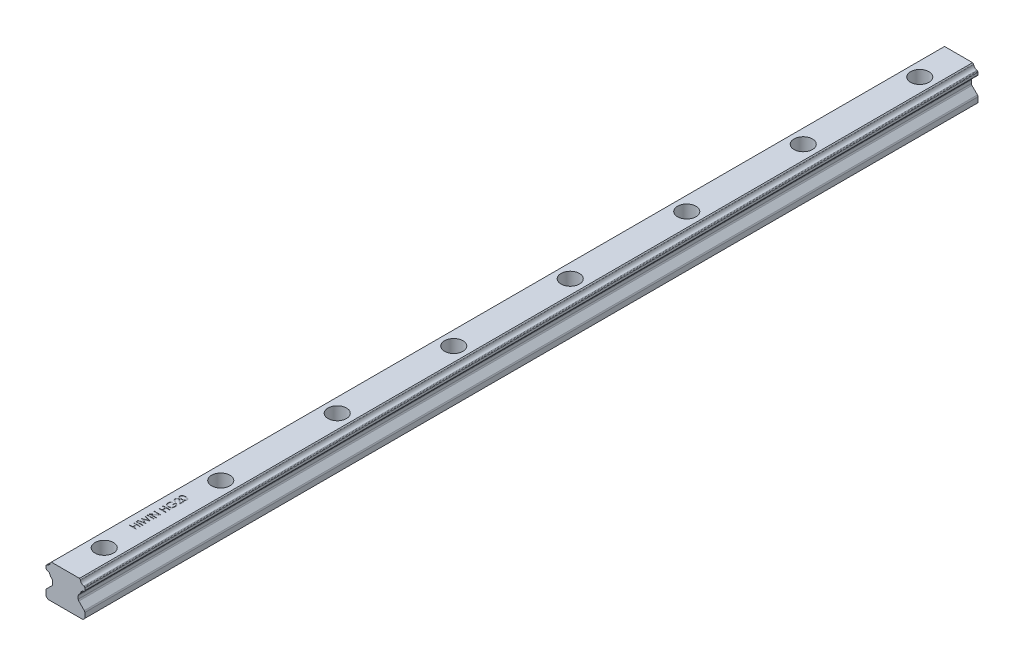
SolidWorks part; units mm, degrees
ref_plane "前视基准面" through (0, 0, 0) normal (0, 0, 1) x (1, 0, 0)
ref_plane "上视基准面" through (0, 0, 0) normal (0, 1, 0) x (1, 0, 0)
ref_plane "右视基准面" through (0, 0, 0) normal (1, 0, 0) x (0, 0, -1)
sketch "草图1" plane through (0, 0, 0) normal (0, 0, 1) x (1, 0, 0)
  line L20 (-10, 3.6565) -> (-10, 1)
  line L21 (6.6, 7.8849) -> (6.6, 9.4451)
  line L22 (9.8536, 14.8772) -> (9.6633, 15.0674)
  line L23 (10, 1) -> (10, 3.6565)
  line L24 (9, 0) -> (10, 1)
  line L25 (-9.8536, 13.1128) -> (-9.6753, 12.9346)
  line L26 (9.7071, 4.3636) -> (6.8929, 7.1778)
  line L27 (-6.8929, 7.1778) -> (-9.7071, 4.3636)
  line L28 (10, 13.4664) -> (10, 14.5236)
  line L29 (-9, 0) -> (9, 0)
  line L30 (7.6477, 17.083) -> (7.2307, 17.5)
  line L31 (7.2307, 17.5) -> (-7.2307, 17.5)
  line L32 (-10, 14.5236) -> (-10, 13.4664)
  line L33 (-9.6633, 15.0674) -> (-9.8536, 14.8772)
  line L34 (-6.6, 9.4451) -> (-6.6, 7.8849)
  line L35 (-10, 1) -> (-9, 0)
  line L36 (6.8929, 10.1522) -> (7.6454, 10.9047)
  line L37 (-7.2307, 17.5) -> (-7.6477, 17.083)
  line L38 (-7.6454, 10.9047) -> (-6.8929, 10.1522)
  line L39 (9.6753, 12.9346) -> (9.8536, 13.1128)
  arc A22 (7.7854, 16.8224) -> (9.4027, 15.2051) centre (9.78, 17.1997) ccw
  arc A23 (-6.6, 9.4451) -> (-6.8929, 10.1522) centre (-7.6, 9.4451) ccw
  arc A24 (7.6454, 10.9047) -> (7.7836, 11.1677) centre (7.2919, 11.2583) ccw
  arc A25 (9.4124, 12.7964) -> (7.7836, 11.1677) centre (9.78, 10.8) ccw
  arc A26 (-9.4027, 15.2051) -> (-9.6633, 15.0674) centre (-9.3098, 14.7138) ccw
  arc A27 (-7.6477, 17.083) -> (-7.7854, 16.8224) centre (-7.2941, 16.7295) ccw
  arc A28 (6.8929, 10.1522) -> (6.6, 9.4451) centre (7.6, 9.4451) ccw
  arc A29 (-9.4027, 15.2051) -> (-7.7854, 16.8224) centre (-9.78, 17.1997) ccw
  arc A30 (-10, 13.4664) -> (-9.8536, 13.1128) centre (-9.5, 13.4664) ccw
  arc A31 (-9.7071, 4.3636) -> (-10, 3.6565) centre (-9, 3.6565) ccw
  arc A32 (9.4124, 12.7964) -> (9.6753, 12.9346) centre (9.3218, 13.2882) ccw
  arc A33 (9.8536, 13.1128) -> (10, 13.4664) centre (9.5, 13.4664) ccw
  arc A34 (10, 14.5236) -> (9.8536, 14.8772) centre (9.5, 14.5236) ccw
  arc A35 (-9.8536, 14.8772) -> (-10, 14.5236) centre (-9.5, 14.5236) ccw
  arc A36 (-7.7836, 11.1677) -> (-9.4124, 12.7964) centre (-9.78, 10.8) ccw
  arc A37 (-7.7836, 11.1677) -> (-7.6454, 10.9047) centre (-7.2919, 11.2583) ccw
  arc A38 (-9.6753, 12.9346) -> (-9.4124, 12.7964) centre (-9.3218, 13.2882) ccw
  arc A39 (10, 3.6565) -> (9.7071, 4.3636) centre (9, 3.6565) ccw
  arc A40 (6.6, 7.8849) -> (6.8929, 7.1778) centre (7.6, 7.8849) ccw
  arc A41 (-6.8929, 7.1778) -> (-6.6, 7.8849) centre (-7.6, 7.8849) ccw
  arc A42 (7.7854, 16.8224) -> (7.6477, 17.083) centre (7.2941, 16.7295) ccw
  arc A43 (9.6633, 15.0674) -> (9.4027, 15.2051) centre (9.3098, 14.7138) ccw
extrude "凸台-拉伸1" add sketch "草图1" against normal blind 460
hole_wizard "M5 六角凹头螺钉的柱形沉头孔1" positions "草图3" profile "草图2" counterbore size "M5" standard "ISO"
sketch "草图3" plane through (-0.2959, 17.5, -3.1046) normal (0, 1, 0) x (-1, 0, 0)
  point P0 (-0.2959, -16.8954)
  dimension "D1" = 20
sketch "草图2" plane through (0, 17.5, -20) normal (1, 0, 0) x (0, 0, 1)
  line L0 (0, 0) -> (0, 17.5)
  line L1 (0, 17.5) -> (3, 17.5)
  line L3 (3, 17.5) -> (3, 8.5)
  line L4 (3, 8.5) -> (4.75, 8.5)
  line L5 (4.75, 8.5) -> (4.75, 0)
  line L7 (4.75, 0) -> (0, 0)
  line L11 (0, -6.35) -> (0, 107.95) construction
  dimension "通孔孔直径" = 6
  dimension "通孔孔深度" = 17.5
  dimension "柱形沉头孔直径" = 9.5
  dimension "柱形沉头孔深度" = 8.5
pattern_linear "阵列(线性)1" count 8 spacing 60 along (0, 0, -1) of "M5 六角凹头螺钉的柱形沉头孔1"
sketch "草图6" plane through (0, 17.5, 0) normal (0, 1, 0) x (1, 0, 0)
  line L0 (0, 20) -> (0, 80) construction
  text T0 "HIWIN HG20"
extrude "切除-拉伸1" cut sketch "草图6" against normal blind 0.1
equation "\"D1@凸台-拉伸1\" = 2 * \"D1@草图3\" + \"D3@阵列(线性)1\" *  ( \"D1@阵列(线性)1\"  - 1) "
